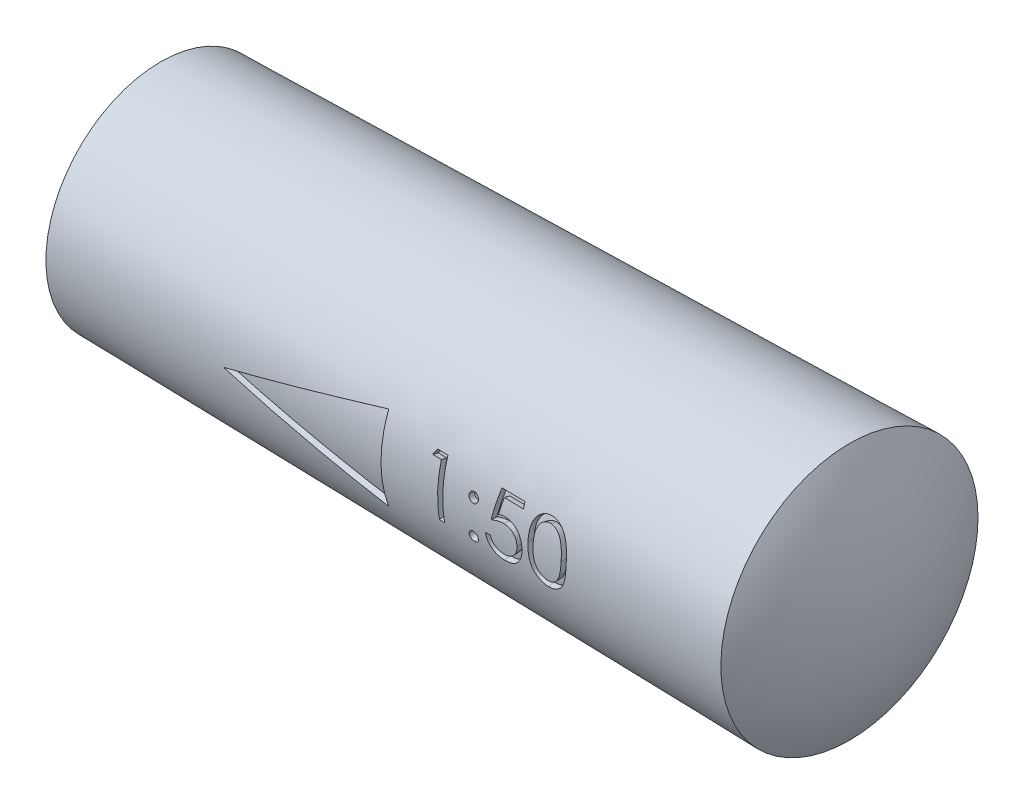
SolidWorks part; units mm, degrees
ref_plane "Front Plane" through (0, 0, 0) normal (0, 0, 1) x (1, 0, 0)
ref_plane "Top Plane" through (0, 0, 0) normal (0, 1, 0) x (1, 0, 0)
ref_plane "Right Plane" through (0, 0, 0) normal (1, 0, 0) x (0, 0, -1)
sketch "Sketch1" plane through (0, 0, 0) normal (1, 0, 0) x (0, 0, -1)
  circle A0 centre (0, 0) radius 2
  dimension "D1" = 4
extrude "Extrude1" add sketch "Sketch1" along normal mid plane 12
draft "Draft1" type of draft neutral plane draft angle 1.146 faces to draft 1 parameters "D1"=1.146
sketch "Sketch2" plane through (0, 0, 0) normal (0, 0, 1) x (1, 0, 0)
  line L0 (-6, 0) -> (-6, 2)
  line L1 (-6, 2) -> (-6, -2) construction
  line L2 (-6, 0) -> (-6.6, 0)
  line L3 (-6.6, 0) -> (-6.6, -2.12) construction
  line L4 (6, 0) -> (6, 2.24)
  line L5 (6, -2.24) -> (6, 2.24) construction
  line L6 (6, 0) -> (6.6, 0)
  line L7 (6.6, 0) -> (6.6, -2.12) construction
  line L8 (-6, -2) -> (6, -2.24) construction
  arc A0 (-6.6, 0) -> (-6, 2) centre (-2.9667, 0) cw
  arc A1 (6.6, 0) -> (6, 2.24) centre (2.1186, 0) ccw
  point P14 (0, -2.12)
revolve "Revolve1" add sketch "Sketch2" angle 360 about L2
sketch "Sketch5" plane through (0, 0, 0) normal (0, 0, 1) x (1, 0, 0)
  line L0 (0, 2.12) -> (0, -2.12) construction
  line L1 (6, 2.24) -> (-6, 2) construction
  line L2 (-6, -2) -> (6, -2.24) construction
ref_plane "Plane2" through (0, 0, 0) normal (-0.02, 0, 0.9998) x (0.9998, 0, 0.02)
sketch "Sketch6" plane through (0, 0, 0) normal (-0.02, 0, 0.9998) x (0.9998, 0, 0.02)
  line L0 (0, 0) -> (0, 0.75)
  line L1 (0, 2.12) -> (0, -2.12) construction
  line L2 (0, 0.75) -> (-2.799, 0)
  line L3 (-2.799, 0) -> (0, -0.75)
  line L4 (0, -0.75) -> (0, 0)
  line L5 (0, -0.375) -> (4, -0.375) construction
  text T0 "1:50" font "Century Gothic" height 1
  dimension "D1" = 1.5
  dimension "D2" = 30
  dimension "D3" = 4
wrap "Wrap2" sketch "Sketch6" wrap type deboss source sketch "Sketch6" thickness 0.1 parameters "D1"=0.1
equation "\"D2@Sketch2\" = \"D1@Sketch2\""
